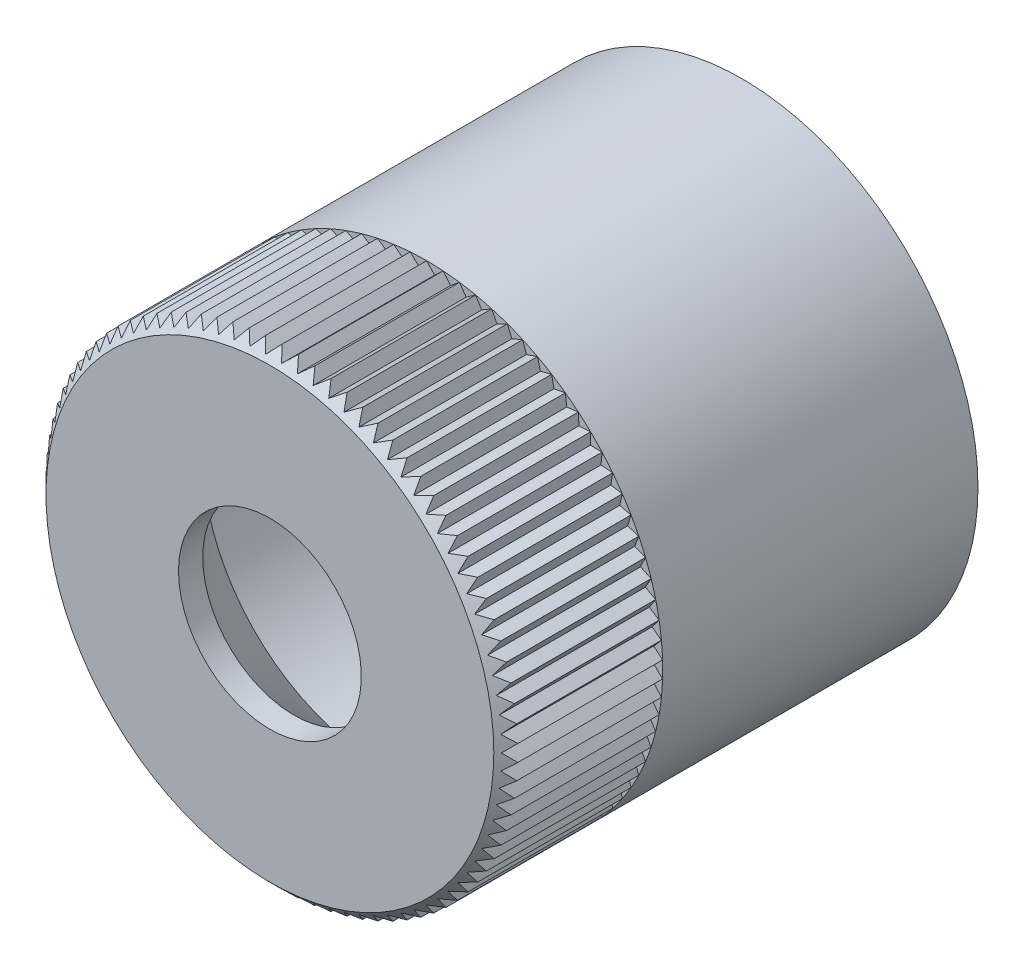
SolidWorks part; units mm, degrees
ref_plane "Front Plane" through (0, 0, 0) normal (0, 0, 1) x (1, 0, 0)
ref_plane "Top Plane" through (0, 0, 0) normal (0, 1, 0) x (1, 0, 0)
ref_plane "Right Plane" through (0, 0, 0) normal (1, 0, 0) x (0, 0, -1)
sketch "Sketch1" plane through (0, 0, 0) normal (0, 0, 1) x (1, 0, 0)
  circle A0 centre (0, 0) radius 6.325
  dimension "D1" = 12.65
extrude "Boss-Extrude1" add sketch "Sketch1" along normal blind 12.65
sketch "Sketch2" plane through (0, 0, 0) normal (0, 0, -1) x (-1, 0, 0)
  circle A0 centre (0, 0) radius 4.8
  dimension "D1" = 9.6
extrude "Cut-Extrude1" cut sketch "Sketch2" against normal blind 9.65
sketch "Sketch3" plane through (0, 0, 9.65) normal (0, 0, -1) x (-1, 0, 0)
  circle A0 centre (0, 0) radius 2.45
  dimension "D1" = 4.9
extrude "Cut-Extrude2" cut sketch "Sketch3" against normal through all
sketch "Sketch4" plane through (0, 0, 9.65) normal (0, 0, -1) x (-1, 0, 0)
  circle A0 centre (0, 0) radius 4.8
  circle A1 centre (0, 0) radius 4.8 construction
extrude "Cut-Extrude3" cut sketch "Sketch4" against normal through all draft 45
sketch "Sketch5" plane through (0, 0, 12.65) normal (0, 0, 1) x (1, 0, 0)
  line L0 (0, 0) -> (0, 6.325) construction
  line L1 (0, 0) -> (0.4412, 6.3096) construction
  line L2 (0, 6.325) -> (0.2129, 6.0967)
  line L3 (0.2129, 6.0967) -> (0.4412, 6.3096)
  circle A0 centre (0, 0) radius 6.325 construction
  arc A1 (0, 6.325) -> (0.4412, 6.3096) centre (0.2283, 6.5379) cw
  dimension "D1" = 4
extrude "Cut-Extrude4" cut sketch "Sketch5" against normal blind 4.2
pattern_circular "CirPattern1" count 90 over 360 about axis through (0, 0, 0) along (0, 0, 1) of "Cut-Extrude4"
chamfer "Chamfer1" distance 0.5 angle 45 1 edges at (-4.8, 0, 0)
sketch "Sketch6" plane through (0, 0, 0) normal (1, 0, 0) x (0, 0, -1)
  circle A0 centre (-1.8, 0) radius 0.8
  point P2 (-1, 0)
  dimension "D2" = 1.6
  dimension "D1" = 1
extrude "Cut-Extrude5" [suppressed] cut sketch "Sketch6" against normal through all both and the other way through all
pattern_circular "CirPattern2" [suppressed] count 2 over 90
sketch "Sketch7" plane through (0, 0, 0) normal (1, 0, 0) x (0, 0, -1)
  line L0 (0, -6.325) -> (0, 6.325) construction
  circle A0 centre (-1.8, 4.8) radius 0.8
  dimension "D1" = 1.6
  dimension "D2" = 1.8
  dimension "D3" = 4.8
revolve "Cut-Revolve1" cut sketch "Sketch7" angle 360 about axis through (0, 0, 12.65) along (0, 0, -1)
sketch "Sketch8" plane through (0, 0, 0) normal (1, 0, 0) x (0, 0, -1)
  line L0 (0, 6.325) -> (-8.45, 6.325) construction
  line L1 (-2.7, 6.325) -> (-1.1, 6.325)
  line L2 (-2.7, 6.325) -> (-2.7, 5.85)
  line L3 (-2.7, 5.85) -> (-1.1, 5.85)
  line L4 (-1.1, 6.325) -> (-1.1, 5.85)
  line L6 (-3.2, 6.325) -> (-4.7, 6.325)
  line L7 (-3.2, 6.325) -> (-3.2, 5.85)
  line L8 (-3.2, 5.85) -> (-4.7, 5.85)
  line L9 (-4.7, 6.325) -> (-4.7, 5.85)
  line L10 (-5.2, 6.325) -> (-6.7, 6.325)
  line L11 (-5.2, 6.325) -> (-5.2, 5.85)
  line L12 (-5.2, 5.85) -> (-6.7, 5.85)
  line L13 (-6.7, 6.325) -> (-6.7, 5.85)
  line L19 (0, 6.325) -> (-8.45, 6.325) construction
  line L24 (-8.7, 6.325) -> (-7.2, 6.325)
  line L25 (-8.7, 6.325) -> (-8.7, 5.85)
  line L26 (-8.7, 5.85) -> (-7.2, 5.85)
  line L27 (-7.2, 6.325) -> (-7.2, 5.85)
  line L28 (0, -6.325) -> (0, 6.325) construction
  line L29 (-9.2, 6.325) -> (-14.2, 6.325)
  line L30 (-9.2, 6.325) -> (-9.2, 5.85)
  line L31 (-9.2, 5.85) -> (-14.2, 5.85)
  line L32 (-14.2, 6.325) -> (-14.2, 5.85)
  line L33 (-14.2, 5.85) -> (-14.2, 0) construction
  line L35 (-14.2, 0) -> (-14.2, -5.85) construction
  line L36 (-9.2, 6.325) -> (-8.7, 6.325) construction
  line L37 (-7.2, 6.325) -> (-6.7, 6.325) construction
  line L38 (-5.2, 6.325) -> (-4.7, 6.325) construction
  line L39 (-3.2, 6.325) -> (-2.7, 6.325) construction
  dimension "D1" = 1.1
  dimension "D2" = 1.6
  dimension "D3" = 9.2
  dimension "D4" = 5
  dimension "D5" = 11.7
  dimension "D6" = 0.5
revolve "Cut-Revolve3" [suppressed] cut sketch "Sketch8" angle 360
sketch "Sketch9" plane through (0, 0, 12.65) normal (0, 0, 1) x (1, 0, 0)
  line L1 (1.4434, 2.5) -> (-1.4434, 2.5)
  line L2 (-1.4434, 2.5) -> (-2.8868, 0)
  line L3 (-2.8868, 0) -> (-1.4434, -2.5)
  line L4 (-1.4434, -2.5) -> (1.4434, -2.5)
  line L5 (1.4434, -2.5) -> (2.8868, 0)
  line L6 (2.8868, 0) -> (1.4434, 2.5)
  circle A0 centre (0, 0) radius 2.5 construction
  dimension "D1" = 5
extrude "Cut-Extrude6" [suppressed] cut sketch "Sketch9" against normal blind 10
sketch "Sketch10" plane through (0, 0, 12.65) normal (0, 0, 1) x (1, 0, 0)
  circle A0 centre (0, 0) radius 6
  dimension "D1" = 12
extrude "Cut-Extrude7" cut sketch "Sketch10" against normal through all draft 45 flip side to cut
